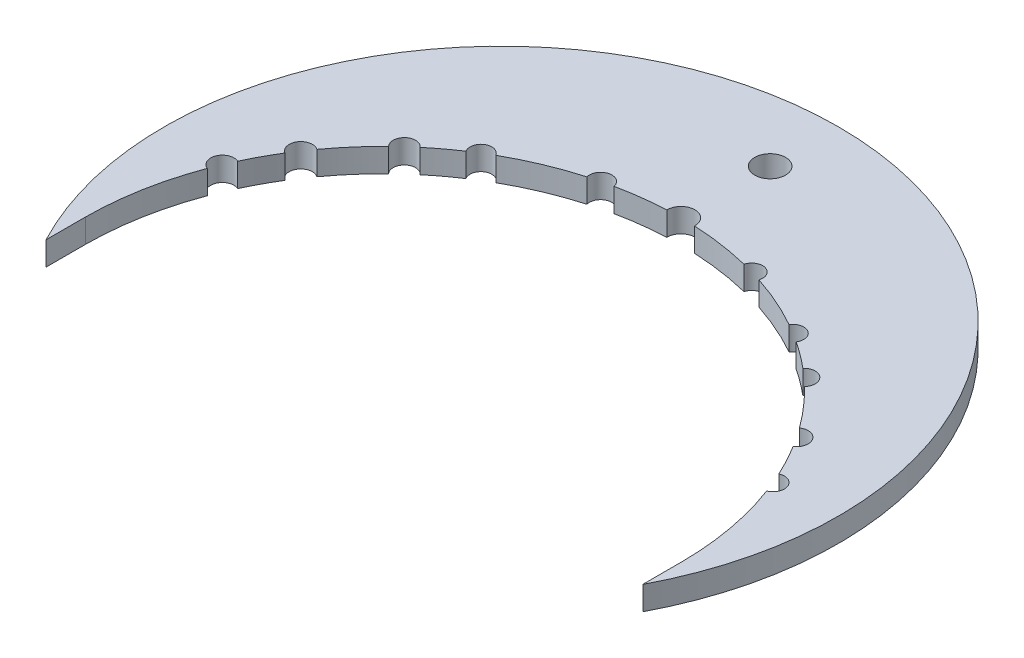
SolidWorks part; units mm, degrees
ref_plane "Front Plane" through (0, 0, 0) normal (0, 0, 1) x (1, 0, 0)
ref_plane "Top Plane" through (0, 0, 0) normal (0, 1, 0) x (1, 0, 0)
ref_plane "Right Plane" through (0, 0, 0) normal (1, 0, 0) x (0, 0, -1)
sketch "Sketch1" plane through (0, 0, 0) normal (0, 1, 0) x (1, 0, 0)
  line L0 (-28.5429, 0) -> (-28.5429, -8.3131)
  line L1 (97.1344, 0) -> (97.1344, -8.3131)
  arc A0 (-28.5429, 0) -> (97.1344, 0) centre (34.2958, -0.278) cw
  arc A1 (97.1344, -8.3131) -> (-28.5429, -8.3131) centre (34.2958, 24.7334) ccw
  circle A2 centre (34.2958, 81.3377) radius 3.25
  arc A3 (-22.6891, 26.2078) -> (-24.2821, 21.5933) centre (-23.678, 23.9669) ccw
  arc A4 (-16.5097, 36.7029) -> (-19.2195, 32.6597) centre (-17.9037, 34.7075) ccw
  arc A5 (-6.0029, 47.9381) -> (-9.498, 44.7873) centre (-7.7799, 46.3954) ccw
  arc A6 (3.4125, 54.4486) -> (-0.4767, 52.0637) centre (1.4462, 53.2914) ccw
  arc A7 (37.2172, 62.4933) -> (31.3744, 62.4933) centre (34.2958, 62.5613) ccw
  arc A8 (69.0682, 52.0637) -> (65.1791, 54.4486) centre (67.1453, 53.2914) ccw
  arc A9 (78.0895, 44.7873) -> (74.5944, 47.9381) centre (76.3714, 46.3954) ccw
  arc A10 (87.811, 32.6597) -> (85.1012, 36.7029) centre (86.4953, 34.7075) ccw
  arc A11 (93.1475, 21.7503) -> (91.3081, 26.1487) centre (92.2695, 23.9669) ccw
  arc A12 (53.8364, 59.4459) -> (49.4123, 60.716) centre (51.6359, 60.1214) ccw
  arc A13 (21.5262, 61.2501) -> (16.9348, 60.1155) centre (19.2198, 60.726) ccw
  point P41 (34.2958, 81.3377)
  dimension "D1" = 6.5
extrude "Boss-Extrude1" add sketch "Sketch1" along normal blind 5
